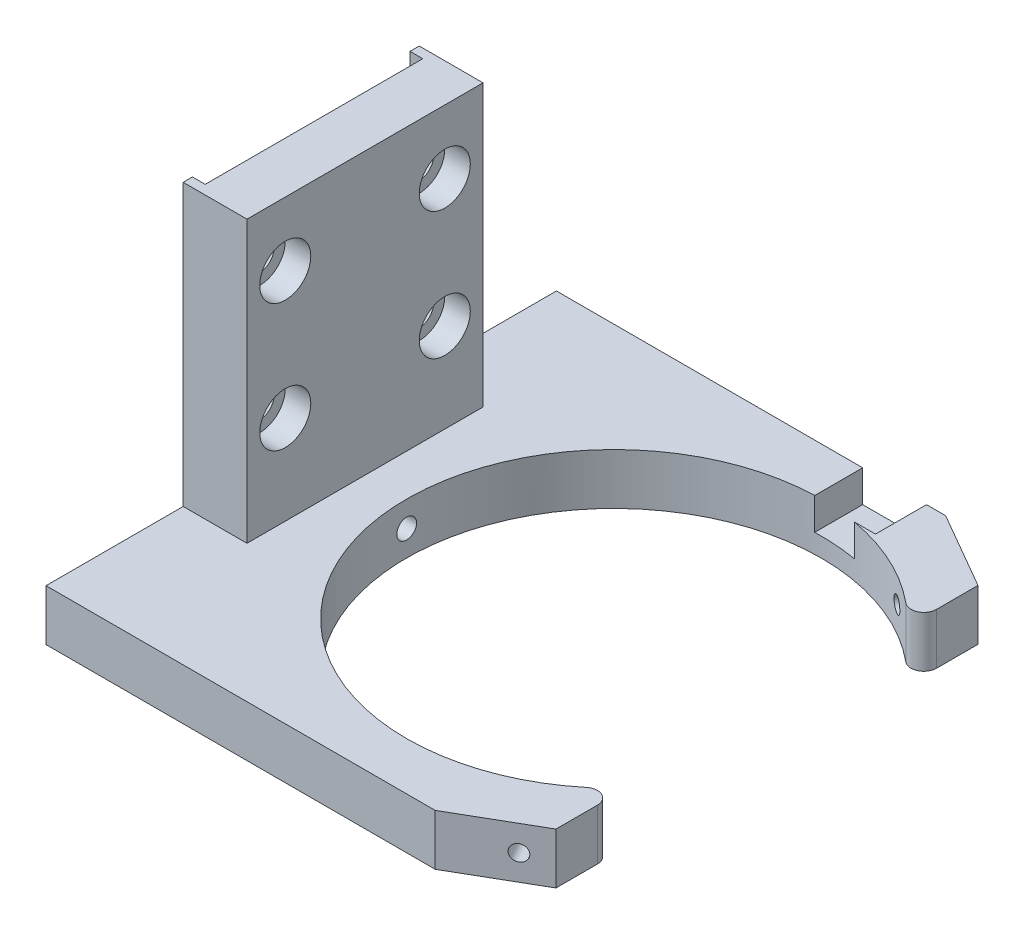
SolidWorks part; units mm, degrees
ref_plane "Front Plane" through (0, 0, 0) normal (0, 0, 1) x (1, 0, 0)
ref_plane "Top Plane" through (0, 0, 0) normal (0, 1, 0) x (1, 0, 0)
ref_plane "Right Plane" through (0, 0, 0) normal (1, 0, 0) x (0, 0, -1)
sketch "Sketch2" plane through (0, 0, 0) normal (0, 1, 0) x (1, 0, 0)
  line L0 (-49, -40) -> (26, -40)
  line L1 (26, 40) -> (26, 19.5)
  line L2 (26, 40) -> (-49, 40)
  line L3 (-49, 40) -> (-49, -40)
  line L4 (26, -19.5) -> (26, -40)
  arc A0 (26, 19.5) -> (26, -19.5) centre (0, 0) ccw
  dimension "D1" = 65
  dimension "D2" = 49
  dimension "D3" = 40
  dimension "D4" = 40
  dimension "D5" = 75
extrude "Boss-Extrude1" add sketch "Sketch2" along normal blind 8
sketch "Sketch3" plane through (0, 8, 0) normal (0, 1, 0) x (1, 0, 0)
  line L0 (-49, 40) -> (-49, -40) construction
  line L1 (-49, -18.5) -> (-39, -18.5)
  line L2 (-49, -18.5) -> (-49, 18.5)
  line L3 (-49, 18.5) -> (-39, 18.5)
  line L4 (-39, -18.5) -> (-39, 18.5)
  line L6 (-49, 18.5) -> (-49, 40) construction
  line L7 (-49, -18.5) -> (-49, -40) construction
  dimension "D1" = 10
  dimension "D3" = 37
extrude "Boss-Extrude2" add sketch "Sketch3" along normal blind 44
sketch "Sketch4" plane through (0, 8, 0) normal (0, 1, 0) x (1, 0, 0)
  line L0 (0, 0) -> (-20.9398, 36.2689) construction
  line L1 (0, 0) -> (-23.1843, -40.1563) construction
  line L2 (26, 40) -> (-49, 40) construction
  line L3 (-49, 18.5) -> (-33, 18.5)
  line L4 (-33, 18.5) -> (4.2391, 40)
  line L5 (4.2391, 40) -> (-49, 40)
  line L6 (-49, 40) -> (-49, 18.5)
  line L7 (-49, -18.5) -> (-33, -18.5)
  line L8 (-33, -18.5) -> (4.2391, -40)
  line L9 (-49, -40) -> (26, -40) construction
  line L10 (4.2391, -40) -> (-49, -40)
  line L11 (-49, -40) -> (-49, -18.5)
  dimension "D1" = 120
  dimension "D2" = 120
  dimension "D3" = 150
  dimension "D4" = 16
  dimension "D5" = 16
  dimension "D6" = 150
extrude "Cut-Extrude1" [suppressed] cut sketch "Sketch4" against normal through all
hole_wizard "M4x0.7 Tapped Hole1" positions "Sketch6" profile "Sketch5" tap size "M4x0.7" standard "ANSI Metric"
sketch "Sketch6" [suppressed] plane through (-15.1112, 0, -26.1734) normal (-0.5, 0, -0.866) x (-0.866, 0, 0.5)
  line L0 (0, 10) -> (0, 0) construction
  line L1 (18.3468, 0) -> (-7.6532, 0) construction
  point P0 (0, 5)
  dimension "D1" = 5
sketch "Sketch5" plane through (-15.1112, 5, -26.1734) normal (0, 1, 0) x (-0.866, 0, 0.5)
  line L0 (0, 0) -> (0, 6.9724)
  line L1 (0, 6.9724) -> (1.65, 6.9724)
  line L2 (1.65, 6.9724) -> (1.65, 0)
  line L5 (1.65, 0) -> (0, 0)
  line L11 (0, -6.35) -> (0, 107.95) construction
  dimension "Thru Tap Drill Dia." = 3.3
  dimension "Thru Tap Drill Depth" = 6.9724
hole_wizard "M4x0.7 Tapped Hole2" positions "Sketch8" profile "Sketch7" tap size "M4x0.7" standard "ANSI Metric"
sketch "Sketch8" [suppressed] plane through (-15.1112, 0, 26.1734) normal (-0.5, 0, 0.866) x (0.866, 0, 0.5)
  line L0 (0, 10) -> (0, 0) construction
  line L1 (7.6532, 0) -> (-18.3468, 0) construction
  point P0 (0, 5)
  dimension "D1" = 5
sketch "Sketch7" plane through (-15.1112, 5, 26.1734) normal (0, 1, 0) x (0.866, 0, 0.5)
  line L0 (0, 0) -> (0, 6.9724)
  line L1 (0, 6.9724) -> (1.65, 6.9724)
  line L2 (1.65, 6.9724) -> (1.65, 0)
  line L5 (1.65, 0) -> (0, 0)
  line L11 (0, -6.35) -> (0, 107.95) construction
  dimension "Thru Tap Drill Dia." = 3.3
  dimension "Thru Tap Drill Depth" = 6.9724
fillet "Fillet1" [suppressed] radius 6
fillet "Fillet2" [suppressed] radius 6
fillet "Fillet3" [suppressed] radius 12
hole_wizard "CBORE for M4 SHCS1" positions "Sketch12" profile "Sketch11" counterbore size "M4" standard "ANSI Metric"
sketch "Sketch12" plane through (-39, 0, 0) normal (1, 0, 0) x (0, 0, -1)
  point P0 (-12.5, 42)
  point P3 (12.5, 42)
  point P6 (12.5, 22)
  point P9 (-12.5, 22)
sketch "Sketch11" plane through (-39, 42, 12.5) normal (0, 1, 0) x (0, 0, -1)
  line L0 (0, 0) -> (0, 10.0001)
  line L1 (0, 10.0001) -> (2.25, 10.0001)
  line L3 (2.25, 10.0001) -> (2.25, 4)
  line L4 (2.25, 4) -> (4, 4)
  line L5 (4, 4) -> (4, 0)
  line L7 (4, 0) -> (0, 0)
  line L11 (0, -6.35) -> (0, 107.95) construction
  dimension "Thru Hole Dia." = 4.5
  dimension "Thru Hole Depth" = 10.0001
  dimension "C'Bore Dia." = 8
  dimension "C'Bore Depth" = 4
sketch "Sketch13" plane through (-49, 0, 0) normal (-1, 0, 0) x (0, 0, 1)
  line L1 (-40, 0) -> (40, 0) construction
  line L2 (-17.05, 0) -> (17.05, 0)
  line L3 (-17.05, 0) -> (-17.05, 52)
  line L4 (-17.05, 52) -> (17.05, 52)
  line L6 (17.05, 0) -> (17.05, 52)
  line L8 (-18.5, 52) -> (18.5, 52) construction
  line L10 (-40, 0) -> (-17.05, 0) construction
  line L11 (17.05, 0) -> (40, 0) construction
  dimension "D1" = 34.1
extrude "Cut-Extrude3" cut sketch "Sketch13" against normal blind 2
hole_wizard "M6x1.0 Tapped Hole2" positions "Sketch19" profile "Sketch18" tap size "M6x1.0" standard "ANSI Metric"
sketch "Sketch19" [suppressed] plane through (-47, 0, 0) normal (-1, 0, 0) x (0, 0, 1)
  point P0 (0, 7)
sketch "Sketch18" plane through (-47, 7, 0) normal (0, 1, 0) x (0, 0, 1)
  line L0 (0, 0) -> (0, 5.5022)
  line L1 (0, 5.5022) -> (2.5, 4)
  line L2 (2.5, 4) -> (2.5, 0)
  line L5 (2.5, 0) -> (0, 0)
  line L10 (0, 5.5022) -> (-2.5, 4) construction
  line L11 (0, -6.35) -> (0, 107.95) construction
  dimension "Tap Drill Dia." = 5
  dimension "Tap Drill Depth" = 4
  dimension "Drill Angle" = 118
sketch "Sketch20" plane through (0, 0, 0) normal (0, -1, 0) x (1, 0, 0)
  line L0 (0, 0) -> (23.094, 40) construction
  line L1 (-49, 40) -> (26, 40) construction
  line L2 (0, 0) -> (-68.6702, 0) construction
  line L3 (0, 0) -> (27.8422, -48.2241) construction
  line L4 (12, 40) -> (24, 33.0718)
  line L5 (24, 33.0718) -> (24, 15)
  line L6 (12, 40) -> (26, 40)
  line L7 (26, 40) -> (26, 15)
  line L8 (26, 15) -> (24, 15)
  dimension "D1" = 120
  dimension "D2" = 120
  dimension "D3" = 90
  dimension "D4" = 14
  dimension "D5" = 25
  dimension "D6" = 2
extrude "Cut-Extrude4" cut sketch "Sketch20" against normal blind 10
fillet "Fillet4" radius 2 1 edges at (24, 4, 21.9146)
mirror "Mirror2" about plane through (0, 0, 0) normal (0, 0, 1) of "Fillet4", "Cut-Extrude4"
fillet "Fillet6" [suppressed] radius 2
hole_wizard "M3x0.5 Tapped Hole1" positions "Sketch31" profile "Sketch30" tap size "M3x0.5" standard "ANSI Metric"
sketch "Sketch31" plane through (20.3205, 0, 35.1962) normal (0.5, 0, 0.866) x (0.866, 0, -0.5)
  line L1 (4.2487, 8) -> (-9.6077, 8) construction
  line L4 (0, 8) -> (0, 0) construction
  point P0 (0, 4)
  dimension "D1" = 4
sketch "Sketch30" plane through (20.3205, 4, 35.1962) normal (0, 1, 0) x (0.866, 0, -0.5)
  line L0 (0, 0) -> (0, 41.3911)
  line L1 (0, 41.3911) -> (1.25, 40.64)
  line L2 (1.25, 40.64) -> (1.25, 0)
  line L5 (1.25, 0) -> (0, 0)
  line L10 (0, 41.3911) -> (-1.25, 40.64) construction
  line L11 (0, -6.35) -> (0, 107.95) construction
  dimension "Tap Drill Dia." = 2.5
  dimension "Tap Drill Depth" = 40.64
  dimension "Drill Angle" = 118
sketch "Sketch34" plane through (0, 8, 0) normal (0, 1, 0) x (1, 0, 0)
  line L0 (12, 40) -> (-49, 40) construction
  line L1 (9, 40) -> (-1, 40)
  line L2 (9, 40) -> (9, 32)
  line L3 (9, 32) -> (-1, 32)
  line L4 (-1, 40) -> (-1, 32)
  line L5 (-49, 40) -> (-49, 18.5) construction
  dimension "D1" = 10
  dimension "D2" = 8
  dimension "D3" = 48
extrude "Cut-Extrude5" cut sketch "Sketch34" against normal blind 5
hole_wizard "Ø3.1 (3.1) Diameter Hole1" positions "Sketch36" profile "Sketch35" hole size "Ø3.1" standard "ANSI Metric"
sketch "Sketch36" plane through (-47, 0, 0) normal (-1, 0, 0) x (0, 0, 1)
  line L0 (0, 8) -> (0, 3) construction
  line L1 (0, 0) -> (0, 4) construction
  line L2 (-17.05, 0) -> (17.05, 0) construction
  line L4 (-40, 8) -> (-18.5, 8) construction
  point P0 (0, 4)
  dimension "D1" = 4
sketch "Sketch35" plane through (-47, 4, 0) normal (0, 1, 0) x (0, 0, 1)
  line L0 (0, 0) -> (0, 68.656)
  line L1 (0, 68.656) -> (1.55, 67.7246)
  line L2 (1.55, 67.7246) -> (1.55, 0)
  line L5 (1.55, 0) -> (0, 0)
  line L10 (0, 68.656) -> (-1.55, 67.7246) construction
  line L11 (0, -6.35) -> (0, 107.95) construction
  dimension "Hole Dia." = 3.1
  dimension "Hole Depth" = 67.7246
  dimension "Drill Angle" = 118
hole_wizard "M4x0.7 Tapped Hole3" positions "Sketch38" profile "Sketch37" tap size "M4x0.7" standard "ANSI Metric"
sketch "Sketch38" plane through (-47, 0, 0) normal (-1, 0, 0) x (0, 0, 1)
  point P14 (0, 4)
sketch "Sketch37" plane through (-47, 4, 0) normal (0, 1, 0) x (0, 0, 1)
  line L0 (0, 0) -> (0, 12.4914)
  line L1 (0, 12.4914) -> (1.65, 11.5)
  line L2 (1.65, 11.5) -> (1.65, 0)
  line L5 (1.65, 0) -> (0, 0)
  line L10 (0, 12.4914) -> (-1.65, 11.5) construction
  line L11 (0, -6.35) -> (0, 107.95) construction
  dimension "Tap Drill Dia." = 3.3
  dimension "Tap Drill Depth" = 11.5
  dimension "Drill Angle" = 118
sketch "Sketch39" plane through (0, 8, 0) normal (0, 1, 0) x (1, 0, 0)
  line L0 (-35.3343, 0) -> (0, 0) construction
  line L1 (-32.463, 0) -> (-35.4399, 0) construction
  line L2 (0, 0) -> (24.0207, -41.6051) construction
  dimension "D1" = 120
sketch "Sketch40" [suppressed] plane through (20.3205, 0, 35.1962) normal (0.5, 0, 0.866) x (0.866, 0, -0.5)
  line L0 (0, 8) -> (0, 0) construction
  line L1 (4.2487, 8) -> (-9.6077, 8) construction
pattern_circular "CirPattern1" count 2 over 240 about axis through (0, 8, 0) along (0, -1, 0) of "M3x0.5 Tapped Hole1"
